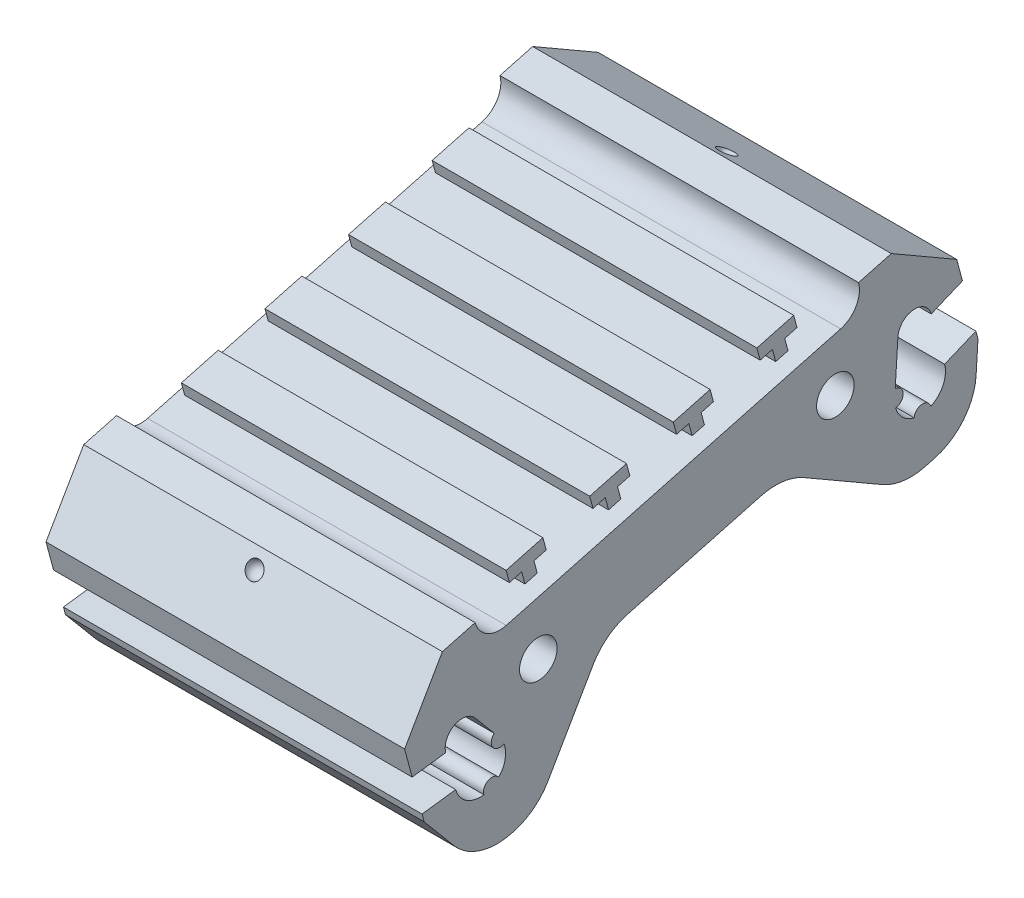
SolidWorks part; units mm, degrees
other "<finger_flexure_print>-<Pulley Cover Fillet>"
ref_plane "Front Plane" through (0, 0, 0) normal (0, 0, 1) x (1, 0, 0)
ref_plane "Top Plane" through (0, 0, 0) normal (0, 1, 0) x (1, 0, 0)
ref_plane "Right Plane" through (0, 0, 0) normal (1, 0, 0) x (0, 0, -1)
inserted part "finger_flexure_print"
sketch "Sketch1" plane through (15.875, 0, 0) normal (1, 0, 0) x (0, 0, -1)
  line L1 (22.651, 3.8851) -> (23.8936, -0.7524)
  line L3 (71.3728, 17.5667) -> (72.9287, 11.7598)
  line L4 (27.7307, 12.0784) -> (63.0336, 21.5378)
  line L5 (81.6646, 21.8297) -> (84.81, 16.6812)
  line L8 (115.3247, 43.1358) -> (116.3122, 42.9188)
  line L10 (-14.375, -14.1005) -> (-11.375, -14.1005) construction
  line L11 (-11.375, 2.75) -> (-10.375, 2.75)
  line L12 (-1.7843, 6.8) -> (-0.3647, 6.8)
  line L15 (-15.375, -17.1005) -> (-15.375, -15.1005) construction
  line L16 (-15.375, -17.1005) -> (-14.375, -17.1005) construction
  line L17 (-14.375, -14.1005) -> (-11.375, -14.1005)
  line L18 (-11.375, -14.1005) -> (-10.375, -15.1005)
  line L19 (-10.375, -15.1005) -> (-10.375, 2.75)
  line L20 (-10.375, 2.75) -> (-11.375, 2.75)
  line L21 (-11.375, 2.75) -> (-11.375, -14.1005)
  line L25 (-11.375, 2.75) -> (-11.375, -14.1005)
  line L26 (-15.375, -17.1005) -> (-15.375, -15.1005)
  line L27 (-15.375, -17.1005) -> (-14.375, -17.1005)
  line L28 (20.625, -14.1005) -> (23.625, -14.1005) construction
  line L29 (24.625, -15.1005) -> (24.625, -17.1005) construction
  line L30 (23.625, -17.1005) -> (24.625, -17.1005) construction
  line L31 (20.625, -14.1005) -> (23.625, -14.1005)
  line L32 (24.625, -15.1005) -> (24.625, -17.1005)
  line L33 (23.625, -17.1005) -> (24.625, -17.1005)
  line L41 (-14.375, -17.1005) -> (23.625, -17.1005)
  line L42 (23.625, -17.1005) -> (23.625, -15.1005)
  line L43 (23.625, -15.1005) -> (20.625, -15.1005)
  line L44 (20.625, -15.1005) -> (20.625, -11.6505)
  line L45 (14.375, -5.4005) -> (12.375, -5.4005)
  line L46 (11.375, -4.4005) -> (11.375, -2.4005)
  line L47 (11.375, -2.4005) -> (23.8936, -0.7524)
  line L48 (23.8936, -0.7524) -> (26.5211, -3.8884)
  line L49 (31.6478, -5.507) -> (31.8116, -5.4631)
  line L50 (34.8476, -3.1335) -> (38.8636, 3.8225)
  line L51 (41.8997, 6.1521) -> (53.7261, 9.321)
  line L52 (57.5202, 8.8215) -> (64.4762, 4.8055)
  line L53 (68.2703, 4.306) -> (69.0649, 4.5189)
  line L54 (72.7614, 9.0414) -> (72.9287, 11.7598)
  line L55 (72.9287, 11.7598) -> (84.81, 16.6812)
  line L56 (84.81, 16.6812) -> (86.8789, 14.9378)
  line L57 (92.7076, 14.4944) -> (93.4693, 14.9598)
  line L58 (95.7229, 18.0527) -> (97.5841, 25.7589)
  line L59 (99.8376, 28.8518) -> (113.4109, 37.1441)
  line L60 (115.6645, 40.237) -> (116.3122, 42.9188)
  line L61 (103.94, 45.9069) -> (83.2549, 33.2698)
  line L62 (82.2755, 29.2145) -> (80.3127, 28.0154)
  line L63 (80.3127, 28.0154) -> (79.6251, 25.1682)
  line L64 (79.6251, 25.1682) -> (81.6646, 21.8297)
  line L65 (81.6646, 21.8297) -> (71.3728, 17.5667)
  line L66 (71.3728, 17.5667) -> (71.0449, 18.7904)
  line L67 (71.0449, 18.7904) -> (65.2552, 22.1331)
  line L68 (65.2552, 22.1331) -> (63.0336, 21.5378)
  line L69 (59.4206, 23.6238) -> (29.8167, 15.6914)
  line L70 (27.7307, 12.0784) -> (25.5091, 11.4831)
  line L71 (25.5091, 11.4831) -> (22.1665, 5.6935)
  line L72 (22.1665, 5.6935) -> (22.651, 3.8851)
  line L73 (22.651, 3.8851) -> (11.375, 2.4005)
  line L74 (11.375, 2.4005) -> (11.375, 4.2728)
  line L75 (11.375, 4.2728) -> (8.8478, 6.8)
  line L76 (8.8478, 6.8) -> (-1.7843, 6.8)
  line L77 (-10.375, 2.75) -> (-10.375, -15.1005)
  line L78 (-10.375, -15.1005) -> (-14.375, -15.1005)
  line L79 (-14.375, -15.1005) -> (-14.375, -17.1005)
  line L80 (-14.375, -17.1005) -> (23.625, -17.1005)
  line L83 (20.625, -14.1005) -> (20.625, -11.6505)
  line L84 (14.375, -5.4005) -> (12.375, -5.4005)
  line L85 (11.375, -4.4005) -> (11.375, -2.4005)
  line L86 (11.375, -2.4005) -> (23.8936, -0.7524)
  line L87 (23.8936, -0.7524) -> (26.5211, -3.8884)
  line L88 (31.6478, -5.507) -> (31.8116, -5.4631)
  line L89 (34.8476, -3.1335) -> (38.8636, 3.8225)
  line L90 (41.8997, 6.1521) -> (53.7261, 9.321)
  line L91 (57.5202, 8.8215) -> (64.4762, 4.8055)
  line L92 (68.2703, 4.306) -> (69.0649, 4.5189)
  line L93 (72.7614, 9.0414) -> (72.9287, 11.7598)
  line L94 (72.9287, 11.7598) -> (84.81, 16.6812)
  line L95 (84.81, 16.6812) -> (86.8789, 14.9378)
  line L96 (92.7076, 14.4944) -> (93.4693, 14.9598)
  line L97 (95.7229, 18.0527) -> (97.5841, 25.7589)
  line L98 (99.8376, 28.8518) -> (113.4109, 37.1441)
  line L99 (115.6645, 40.237) -> (116.3122, 42.9188)
  line L100 (103.94, 45.9069) -> (83.2549, 33.2698)
  line L101 (82.2755, 29.2145) -> (80.3127, 28.0154)
  line L102 (80.3127, 28.0154) -> (79.6251, 25.1682)
  line L103 (79.6251, 25.1682) -> (81.6646, 21.8297)
  line L104 (81.6646, 21.8297) -> (71.3728, 17.5667)
  line L105 (71.3728, 17.5667) -> (71.0449, 18.7904)
  line L106 (71.0449, 18.7904) -> (65.2552, 22.1331)
  line L107 (65.2552, 22.1331) -> (63.0336, 21.5378)
  line L108 (59.4206, 23.6238) -> (29.8167, 15.6914)
  line L109 (27.7307, 12.0784) -> (25.5091, 11.4831)
  line L110 (25.5091, 11.4831) -> (22.1665, 5.6935)
  line L111 (22.1665, 5.6935) -> (22.651, 3.8851)
  line L112 (22.651, 3.8851) -> (11.375, 2.4005)
  line L113 (11.375, 2.4005) -> (11.375, 4.2728)
  line L114 (11.375, 4.2728) -> (8.8478, 6.8)
  line L115 (8.8478, 6.8) -> (-0.3647, 6.8)
  arc A2 (115.3247, 43.1358) -> (104.305, 45.3096) centre (108.632, 38.2267) ccw construction
  arc A3 (115.3247, 43.1358) -> (110.3269, 46.3519) centre (108.632, 38.2267) ccw
  arc A7 (-14.375, -14.1005) -> (-15.375, -15.1005) centre (-14.375, -15.1005) ccw construction
  arc A8 (-14.375, -14.1005) -> (-15.375, -15.1005) centre (-14.375, -15.1005) ccw
  arc A9 (-1.7843, 6.8) -> (-10.375, 2.75) centre (-5.125, 2.75) ccw
  arc A10 (-0.3647, 6.8) -> (-11.375, 2.75) centre (-5.125, 2.75) ccw
  arc A12 (-0.3647, 6.8) -> (-11.375, 2.75) centre (-5.125, 2.75) ccw
  arc A13 (24.625, -15.1005) -> (23.625, -14.1005) centre (23.625, -15.1005) ccw construction
  arc A14 (24.625, -15.1005) -> (23.625, -14.1005) centre (23.625, -15.1005) ccw
  arc A21 (20.625, -11.6505) -> (14.375, -5.4005) centre (14.375, -11.6505) ccw
  arc A22 (11.375, -4.4005) -> (12.375, -5.4005) centre (12.375, -4.4005) ccw
  arc A23 (26.5211, -3.8884) -> (31.6478, -5.507) centre (30.3537, -0.6773) ccw
  arc A24 (31.8116, -5.4631) -> (34.8476, -3.1335) centre (30.5175, -0.6335) ccw
  arc A25 (41.8997, 6.1521) -> (38.8636, 3.8225) centre (43.1937, 1.3225) ccw
  arc A26 (57.5202, 8.8215) -> (53.7261, 9.321) centre (55.0202, 4.4914) ccw
  arc A27 (64.4762, 4.8055) -> (68.2703, 4.306) centre (66.9762, 9.1356) ccw
  arc A28 (69.0649, 4.5189) -> (72.7614, 9.0414) centre (67.7708, 9.3485) ccw
  arc A29 (86.8789, 14.9378) -> (92.7076, 14.4944) centre (90.1009, 18.7612) ccw
  arc A30 (93.4693, 14.9598) -> (95.7229, 18.0527) centre (90.8626, 19.2265) ccw
  arc A31 (99.8376, 28.8518) -> (97.5841, 25.7589) centre (102.4443, 24.5851) ccw
  arc A32 (113.4109, 37.1441) -> (115.6645, 40.237) centre (110.8043, 41.4109) ccw
  arc A33 (116.3122, 42.9188) -> (103.94, 45.9069) centre (108.632, 38.2267) ccw
  arc A34 (83.2549, 33.2698) -> (82.2755, 29.2145) centre (84.7928, 30.7524) ccw
  arc A35 (63.0336, 21.5378) -> (59.4206, 23.6238) centre (60.1841, 20.7743) ccw
  arc A36 (29.8167, 15.6914) -> (27.7307, 12.0784) centre (30.5802, 12.8419) ccw
  arc A37 (-1.7843, 6.8) -> (-10.375, 2.75) centre (-5.125, 2.75) ccw
  arc A38 (20.625, -11.6505) -> (14.375, -5.4005) centre (14.375, -11.6505) ccw
  arc A39 (11.375, -4.4005) -> (12.375, -5.4005) centre (12.375, -4.4005) ccw
  arc A40 (26.5211, -3.8884) -> (31.6478, -5.507) centre (30.3537, -0.6773) ccw
  arc A41 (31.8116, -5.4631) -> (34.8476, -3.1335) centre (30.5175, -0.6335) ccw
  arc A42 (41.8997, 6.1521) -> (38.8636, 3.8225) centre (43.1937, 1.3225) ccw
  arc A43 (57.5202, 8.8215) -> (53.7261, 9.321) centre (55.0202, 4.4914) ccw
  arc A44 (64.4762, 4.8055) -> (68.2703, 4.306) centre (66.9762, 9.1356) ccw
  arc A45 (69.0649, 4.5189) -> (72.7614, 9.0414) centre (67.7708, 9.3485) ccw
  arc A46 (86.8789, 14.9378) -> (92.7076, 14.4944) centre (90.1009, 18.7612) ccw
  arc A47 (93.4693, 14.9598) -> (95.7229, 18.0527) centre (90.8626, 19.2265) ccw
  arc A48 (99.8376, 28.8518) -> (97.5841, 25.7589) centre (102.4443, 24.5851) ccw
  arc A49 (113.4109, 37.1441) -> (115.6645, 40.237) centre (110.8043, 41.4109) ccw
  arc A50 (116.3122, 42.9188) -> (103.94, 45.9069) centre (108.632, 38.2267) ccw
  arc A51 (83.2549, 33.2698) -> (82.2755, 29.2145) centre (84.7928, 30.7524) ccw
  arc A52 (63.0336, 21.5378) -> (59.4206, 23.6238) centre (60.1841, 20.7743) ccw
  arc A53 (29.8167, 15.6914) -> (27.7307, 12.0784) centre (30.5802, 12.8419) ccw
  dimension "D1" = 0
  dimension "D2" = 0
  dimension "D3" = 0
extrude "Piece Cut" cut sketch "Sketch1" against normal through all
ref_point "Ref Center"
